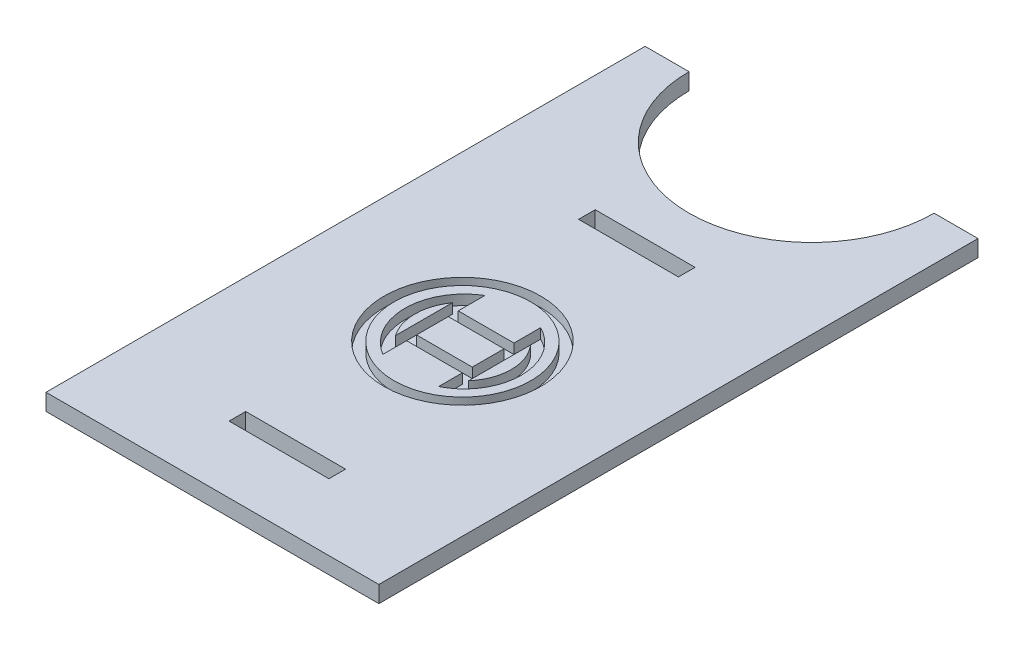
SolidWorks part; units mm, degrees
ref_plane "Alzado" through (0, 0, 0) normal (0, 0, 1) x (1, 0, 0)
ref_plane "Planta" through (0, 0, 0) normal (0, 1, 0) x (1, 0, 0)
ref_plane "Vista lateral" through (0, 0, 0) normal (1, 0, 0) x (0, 0, -1)
sketch "Croquis1" plane through (0, 0, 0) normal (0, 1, 0) x (1, 0, 0)
  line L1 (372.332, 49.0936) -> (385.5164, 49.0936)
  line L8 (320.5164, -110.9064) -> (350.5164, -110.9064)
  line L9 (285.5164, -130.9064) -> (385.5164, -130.9064)
  line L10 (285.5164, -130.9064) -> (285.5164, 49.0936)
  line L11 (285.5164, 49.0936) -> (298.7008, 49.0936)
  line L12 (385.5164, -130.9064) -> (385.5164, 49.0936)
  line L13 (350.5164, -110.9064) -> (350.5164, -105.9064)
  line L14 (350.5164, -105.9064) -> (320.5164, -105.9064)
  line L15 (320.5164, -105.9064) -> (320.5164, -110.9064)
  line L17 (320.5164, -5.9064) -> (320.5164, -0.9064)
  line L18 (350.5164, -5.9064) -> (320.5164, -5.9064)
  line L19 (350.5164, -0.9064) -> (350.5164, -5.9064)
  line L20 (320.5164, -0.9064) -> (350.5164, -0.9064)
  arc A0 (372.332, 49.0936) -> (298.7008, 49.0936) centre (335.5164, 49.0936) cw
  point P0 (-30.909, -85.6617)
  point P1 (-30.909, 14.3383)
  point P2 (39.8017, 85.049)
  point P3 (210.5124, 14.3383)
  point P4 (139.8017, 85.049)
  point P6 (210.5124, -85.6617)
  point P7 (139.8017, -156.3724)
  point P8 (39.8017, -156.3724)
  point P14 (-35.909, -85.6617)
  point P17 (-35.909, 16.4093)
  point P22 (37.7306, 90.049)
  point P23 (141.8728, 90.049)
  point P24 (214.0479, 17.8738)
  point P25 (214.0479, -89.1973)
  point P26 (141.8728, -161.3724)
  point P27 (37.7306, -161.3724)
  point P28 (-34.4445, -89.1973)
  point P29 (215.5124, 14.3383)
  point P30 (215.5124, -85.6617)
  point P36 (-30.909, -20.6617)
  point P37 (210.5124, -20.6617)
  point P38 (210.5124, -50.6617)
  point P39 (-30.909, -50.6617)
  point P40 (164.5504, -131.6237)
  point P41 (-6.1602, 39.087)
  point P42 (15.053, 60.3002)
  point P43 (185.7636, -110.4105)
  dimension "D2" = 100
  dimension "D14" = 100
  dimension "D15" = 5
  dimension "D16" = 180
  dimension "D18" = 35
  dimension "D19" = 20
extrude "Saliente-Extruir1" add sketch "Croquis1" along normal blind 5
sketch "Croquis2" plane through (0, 5, 0) normal (0, 1, 0) x (1, 0, 0)
  line L0 (-1107.983, 756.6761) -> (70.6836, 756.6761) construction
  line L1 (326.2609, -39.7885) -> (326.2609, -47.801)
  line L2 (326.2609, -50.801) -> (343.0029, -50.801)
  line L3 (343.0029, -70.445) -> (343.0029, -63.3253)
  line L4 (326.2609, -60.3253) -> (343.0029, -60.3253)
  line L5 (346.0029, -64.4134) -> (346.0029, -45.8201)
  line L6 (323.2609, -46.5771) -> (323.2609, -63.6563)
  line L7 (326.2609, -47.801) -> (343.0029, -47.801)
  line L8 (326.2609, -63.3253) -> (343.0029, -63.3253)
  line L9 (326.2609, -50.801) -> (326.2609, -60.3253)
  line L10 (343.0029, -47.801) -> (343.0029, -39.7885)
  line L12 (343.0029, -60.3253) -> (343.0029, -50.801)
  line L14 (326.2609, -63.3253) -> (326.2609, -70.445)
  circle A0 centre (334.8079, -55.0962) radius 20.5436
  arc A1 (326.2609, -39.7885) -> (326.2609, -70.445) centre (335.4132, -55.1167) ccw
  arc A2 (343.0029, -39.7885) -> (343.0029, -70.445) centre (335.3713, -55.1167) cw
  arc A3 (346.0029, -45.8201) -> (346.0029, -64.4134) centre (335.3713, -55.1167) cw
  arc A4 (323.2609, -46.5771) -> (323.2609, -63.6563) centre (335.4132, -55.1167) ccw
  circle A5 centre (334.8079, -55.0962) radius 23.5436
  point P2 (329.4641, -51.9988)
  point P5 (329.4641, -82.6553)
  point P7 (346.2061, -82.6553)
  point P8 (346.2061, -51.9988)
extrude "Cortar-Extruir2" cut sketch "Croquis2" against normal blind 3 contours A5 A0 | A2 L10 L7 L1 A1 L14 L8 L3 A4 L6 L12 L4 L9 L2 L5 A3
